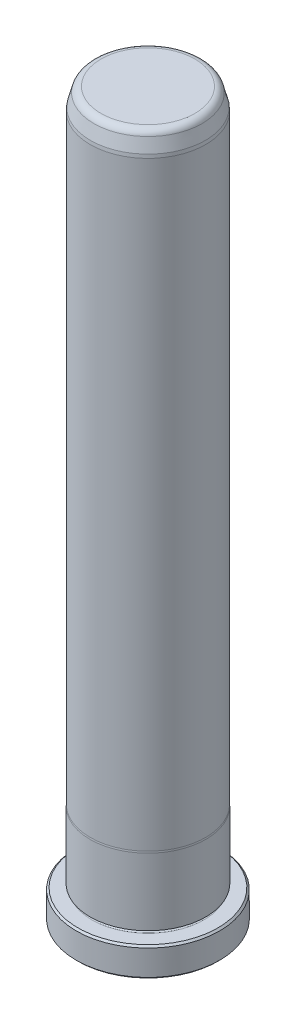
SolidWorks part; units mm, degrees
ref_plane "Front Plane" through (0, 0, 0) normal (0, 0, 1) x (1, 0, 0)
ref_plane "Top Plane" through (0, 0, 0) normal (0, 1, 0) x (1, 0, 0)
ref_plane "Right Plane" through (0, 0, 0) normal (1, 0, 0) x (0, 0, -1)
sketch "Sketch1" plane through (0, 0, 0) normal (1, 0, 0) x (0, 0, -1)
  line L0 (0, 0) -> (15.748, 0)
  line L1 (15.748, 0) -> (15.748, 6.35)
  line L2 (15.748, 6.35) -> (12.3063, 6.35)
  line L3 (11.9253, 4.7498) -> (11.9253, 5.5118) construction
  line L4 (12.3063, 7.112) -> (12.7127, 7.112)
  line L5 (12.7127, 7.112) -> (12.7127, 21.8618)
  line L6 (12.7127, 21.8618) -> (12.6873, 22.225)
  line L7 (12.6873, 22.225) -> (12.6873, 154.0002)
  line L9 (11.5521, 158.75) -> (0, 158.75)
  line L10 (0, 158.75) -> (0, 0)
  line L11 (0, 0) -> (0, -13.6287) construction
  line L12 (12.6873, 154.0002) -> (12.6206, 154.7622)
  line L13 (12.6206, 154.7622) -> (11.5521, 158.75)
  arc A0 (12.3063, 7.112) -> (12.3063, 6.35) centre (12.3063, 6.731) ccw
  dimension "D14" = 0.762
  dimension "T" = 6.35
  dimension "D2" = 0.762
  dimension "M" = 31.496
  dimension "B" = 25.4254
  dimension "L" = 158.75
  dimension "D7" = 0.7874
  dimension "A" = 22.225
  dimension "D8" = 4
  dimension "D10" = 5
  dimension "D11" = 15
  dimension "D12" = 0.762
  dimension "K" = 4.7498
  dimension "D" = 25.3746
revolve "Revolve1" add sketch "Sketch1" angle 360 about L11
fillet "Fillet6" radius 1.5875 1 edges at (0, 158.75, 11.5521)
chamfer "Chamfer1" distance 0.381 angle 45 2 edges at (0, 0, 15.748) (0, 6.35, 15.748)
